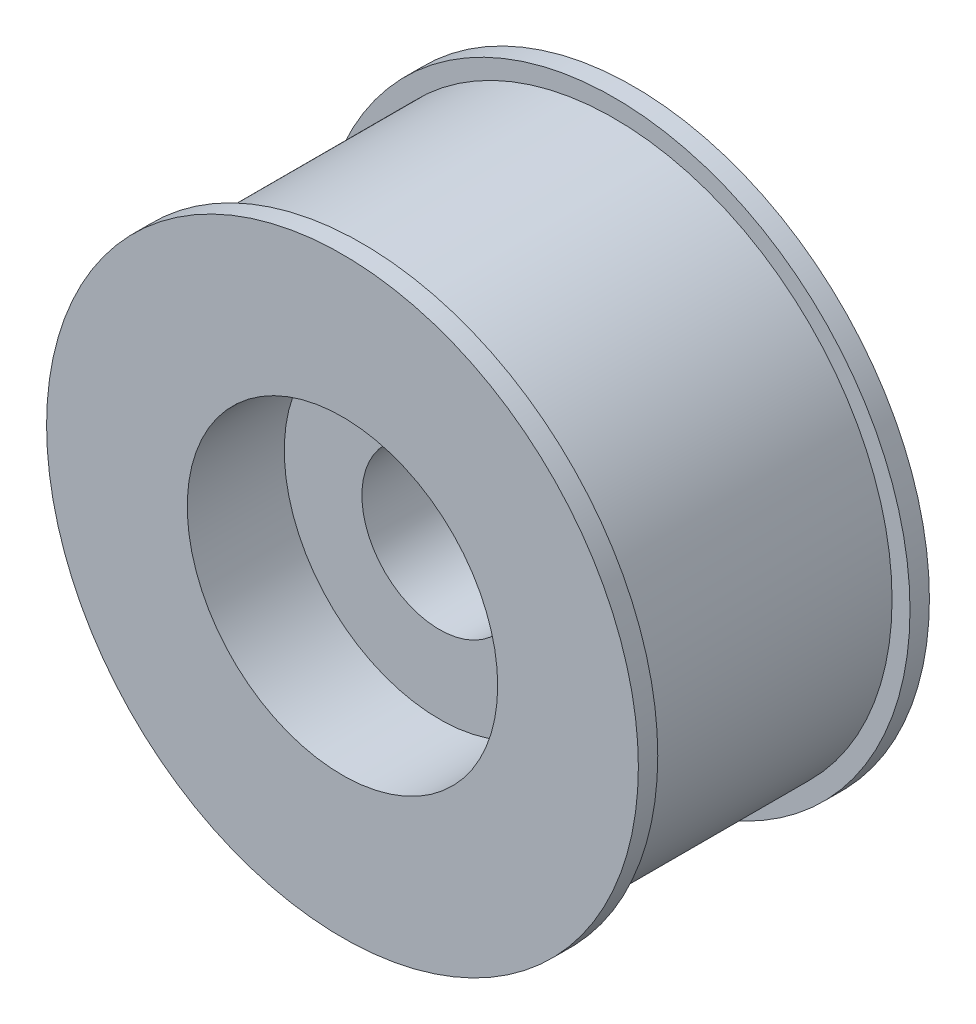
SolidWorks part; units mm, degrees
other "Markup1"
sketch "Sketch2" plane through (30.5, -30.5, 0) normal (0.9536, -0.2879, 0.0877) x (-0.1432, -0.6904, -0.7092)
ref_plane "Front Plane" through (0, 0, 0) normal (0, 0, 1) x (1, 0, 0)
ref_plane "Top Plane" through (0, 0, 0) normal (0, 1, 0) x (1, 0, 0)
ref_plane "Right Plane" through (0, 0, 0) normal (1, 0, 0) x (0, 0, -1)
sketch "Sketch1" plane through (0, 0, 0) normal (1, 0, 0) x (0, 0, -1)
  line L0 (0, 0) -> (0, 30.5)
  line L1 (0, 30.5) -> (2, 30.5)
  line L2 (2, 30.5) -> (2, 28.65)
  line L3 (2, 28.65) -> (28, 28.65)
  line L4 (28, 28.65) -> (28, 30.5)
  line L5 (28, 30.5) -> (30, 30.5)
  line L6 (30, 30.5) -> (30, 19)
  line L7 (30, 19) -> (36, 19)
  line L8 (36, 19) -> (36, 0)
  line L9 (-18.1622, 0) -> (60.1622, 0) construction
  line L10 (0, 0) -> (36, 0)
  dimension "D1" = 57.3
  dimension "D2" = 36
  dimension "D3" = 30
  dimension "D4" = 2
  dimension "D5" = 2
  dimension "D6" = 61
  dimension "D7" = 61
  dimension "D8" = 38
revolve "Revolve1" add sketch "Sketch1" angle 360 about L9
sketch "Sketch3" plane through (0, 0, -36) normal (0, 0, -1) x (-1, 0, 0)
  circle A0 centre (0, 0) radius 16
  dimension "D1" = 32
extrude "Cut-Extrude1" cut sketch "Sketch3" against normal blind 10
sketch "Sketch4" plane through (0, 0, 0) normal (0, 0, 1) x (1, 0, 0)
  circle A0 centre (0, 0) radius 16
  dimension "D1" = 32
extrude "Cut-Extrude2" cut sketch "Sketch4" against normal blind 10
sketch "Sketch5" plane through (0, 0, -10) normal (0, 0, 1) x (1, 0, 0)
  circle A0 centre (0, 0) radius 8
  dimension "D1" = 16
extrude "Cut-Extrude3" cut sketch "Sketch5" against normal blind 20
